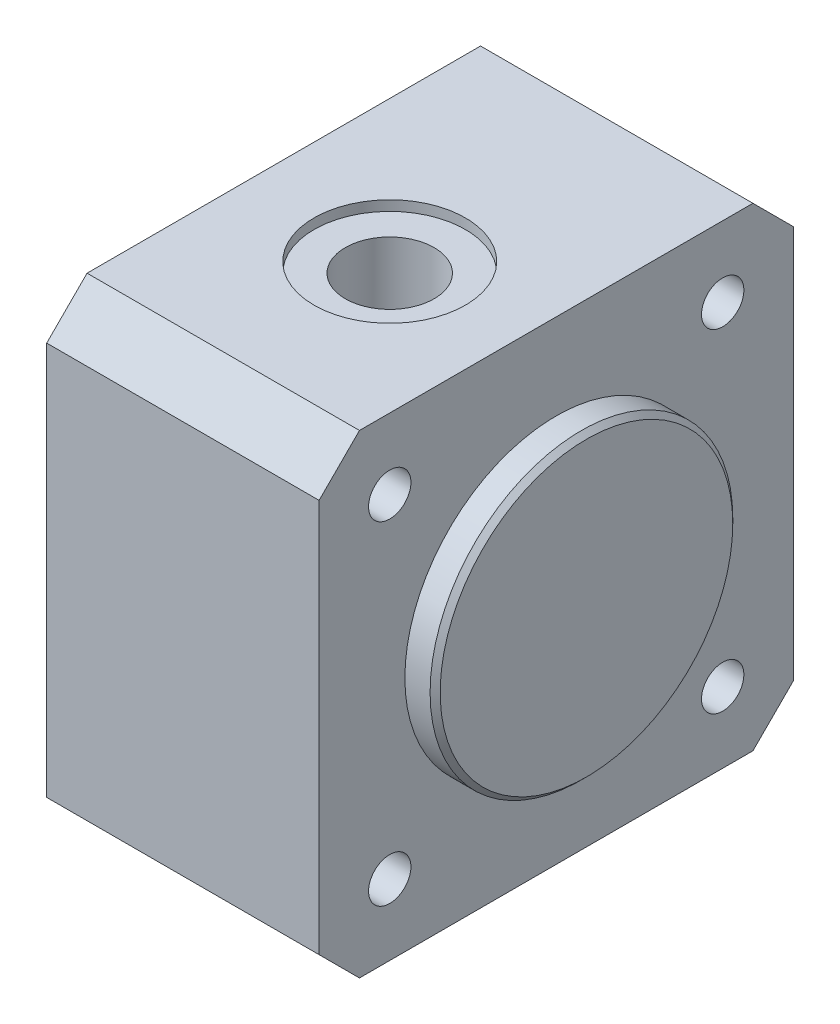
SolidWorks part; units mm, degrees
ref_plane "Front Plane" through (0, 0, 0) normal (0, 0, 1) x (1, 0, 0)
ref_plane "Top Plane" through (0, 0, 0) normal (0, 1, 0) x (1, 0, 0)
ref_plane "Right Plane" through (0, 0, 0) normal (1, 0, 0) x (0, 0, -1)
sketch "Sketch1" plane through (0, 0, 0) normal (1, 0, 0) x (0, 0, -1)
  line L1 (0, 0) -> (47, 0)
  line L2 (0, 0) -> (0, 47)
  line L3 (0, 47) -> (47, 47)
  line L4 (47, 0) -> (47, 47)
  dimension "D1" = 47
  dimension "D2" = 47
extrude "Extrude1" add sketch "Sketch1" along normal blind 27
chamfer "Chamfer1" distance 4 angle 45 4 edges at (13.5, 0, -47) (13.5, 0, 0) (13.5, 47, -47) (13.5, 47, 0)
hole_wizard "Tap Drill for M5 Tap1" positions "Sketch3" profile "Sketch2" hole size "M5" standard "ISO"
sketch "Sketch3" plane through (27, 0, 0) normal (1, 0, 0) x (0, 0, -1)
  line L0 (7, 10.3194) -> (7, 1.6038) construction
  line L1 (2.7468, 7) -> (10.1051, 7) construction
  line L2 (0, 43) -> (0, 4) construction
  line L3 (4, 0) -> (43, 0) construction
  point P11 (7, 7)
  dimension "D1" = 7
  dimension "D2" = 7
sketch "Sketch2" plane through (27, 7, -7) normal (0, 1, 0) x (0, 0, -1)
  line L0 (0, 0) -> (0, 27)
  line L1 (0, 27) -> (2.1, 27)
  line L2 (2.1, 27) -> (2.1, 0)
  line L5 (2.1, 0) -> (0, 0)
  line L11 (0, -6.35) -> (0, 107.95) construction
  dimension "Thru Hole Dia." = 4.2
  dimension "Thru Hole Depth" = 27
pattern_linear "LPattern1" count 2 spacing 33 along (0, 0, -1) count 2 spacing 33 along (0, 1, 0) of "Tap Drill for M5 Tap1"
sketch "Sketch4" plane through (27, 0, 0) normal (1, 0, 0) x (0, 0, -1)
  circle A0 centre (23.5, 23.5) radius 15
  dimension "D1" = 30
extrude "Extrude2" add sketch "Sketch4" along normal blind 3
chamfer "Chamfer2" distance 0.5 angle 45 1 edges at (30, 23.5, -38.5)
sketch "Sketch5" plane through (0, 0, 0) normal (-1, 0, 0) x (0, 0, 1)
  circle A0 centre (-23.5, 23.5) radius 16.5
  dimension "D1" = 33
extrude "Extrude3" add sketch "Sketch5" along normal blind 7
ref_plane "Plane1" through (0, 23.5, 0) normal (0, 1, 0) x (-1, 0, 0)
sketch "Sketch6" plane through (0, 23.5, 0) normal (0, 1, 0) x (-1, 0, 0)
  line L0 (0, -23.5) -> (13.736, -23.5) construction
  line L1 (0, -43) -> (0, -4) construction
  circle A0 centre (3.3915, -7.0368) radius 1
  dimension "D1" = 2
revolve "Cut-Revolve1" cut sketch "Sketch6" angle 360 about L0
sketch "Sketch7" plane through (-7, 0, 0) normal (-1, 0, 0) x (0, 0, 1)
  circle A0 centre (-23.5, 23.5) radius 7.5
  dimension "D1" = 15
extrude "Cut-Extrude1" cut sketch "Sketch7" against normal blind 27
sketch "Sketch8" plane through (0, 47, 0) normal (0, 1, 0) x (1, 0, 0)
  line L0 (6.0385, 20) -> (25.2128, 20) construction
  line L1 (14, 5.3079) -> (14, 24.6395) construction
  line L2 (27, 8.5) -> (27, 38.5) construction
  line L3 (27, 0) -> (0, 0) construction
  dimension "D1" = 13
  dimension "D2" = 20
hole_wizard "Tap Drill for M10x1.25 Tap1" positions "3DSketch1" profile "Sketch9" hole size "M10x1.25" standard "ISO"
sketch3d "3DSketch1"
  line L0 (6.0385, 47, -20) -> (25.2128, 47, -20) construction
  line L1 (14, 47, -5.3079) -> (14, 47, -24.6395) construction
  point P0 (14, 47, -20)
sketch "Sketch9" plane through (14, 47, -20) normal (1, 0, 0) x (0, 0, 1)
  line L0 (0, 0) -> (0, 16.8668)
  line L1 (0, 16.8668) -> (4.4, 16.8668)
  line L2 (4.4, 16.8668) -> (4.4, 0)
  line L5 (4.4, 0) -> (0, 0)
  line L11 (0, -6.35) -> (0, 107.95) construction
  dimension "Thru Hole Dia." = 8.8
  dimension "Thru Hole Depth" = 16.8668
sketch "Sketch10" plane through (0, 47, 0) normal (0, 1, 0) x (1, 0, 0)
  line L0 (6.0385, 20) -> (25.2128, 20) construction
  line L1 (14, 5.3079) -> (14, 24.6395) construction
  circle A0 centre (14, 20) radius 7.5
  dimension "D1" = 15
extrude "Cut-Extrude2" cut sketch "Sketch10" against normal blind 1
